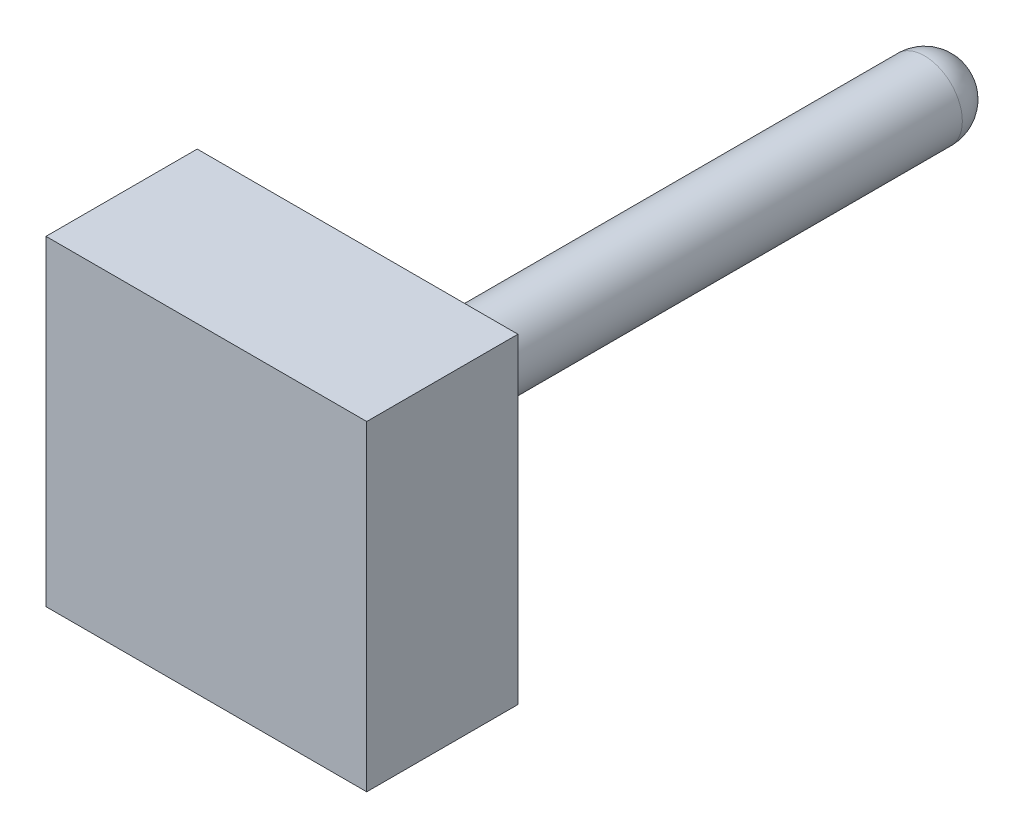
SolidWorks part; units mm, degrees
ref_plane "Front Plane" through (0, 0, 0) normal (0, 0, 1) x (1, 0, 0)
ref_plane "Top Plane" through (0, 0, 0) normal (0, 1, 0) x (1, 0, 0)
ref_plane "Right Plane" through (0, 0, 0) normal (1, 0, 0) x (0, 0, -1)
sketch "Sketch1" plane through (0, 0, 0) normal (0, 0, 1) x (1, 0, 0)
  circle A0 centre (0, 0) radius 0.3969
extrude "Extrude1" add sketch "Sketch1" along normal blind 6.35
sketch "Sketch2" plane through (0, 0, 6.35) normal (0, 0, 1) x (1, 0, 0)
  line L1 (-1.6838, -1.6838) -> (1.6838, -1.6838)
  line L2 (-1.6838, -1.6838) -> (-1.6838, 1.6838)
  line L3 (-1.6838, 1.6838) -> (1.6838, 1.6838)
  line L4 (1.6838, -1.6838) -> (1.6838, 1.6838)
extrude "Extrude3" add sketch "Sketch2" along normal blind 1.5875
fillet "Fillet2" radius 0.3969 1 edges at (0.3969, 0, 0)
